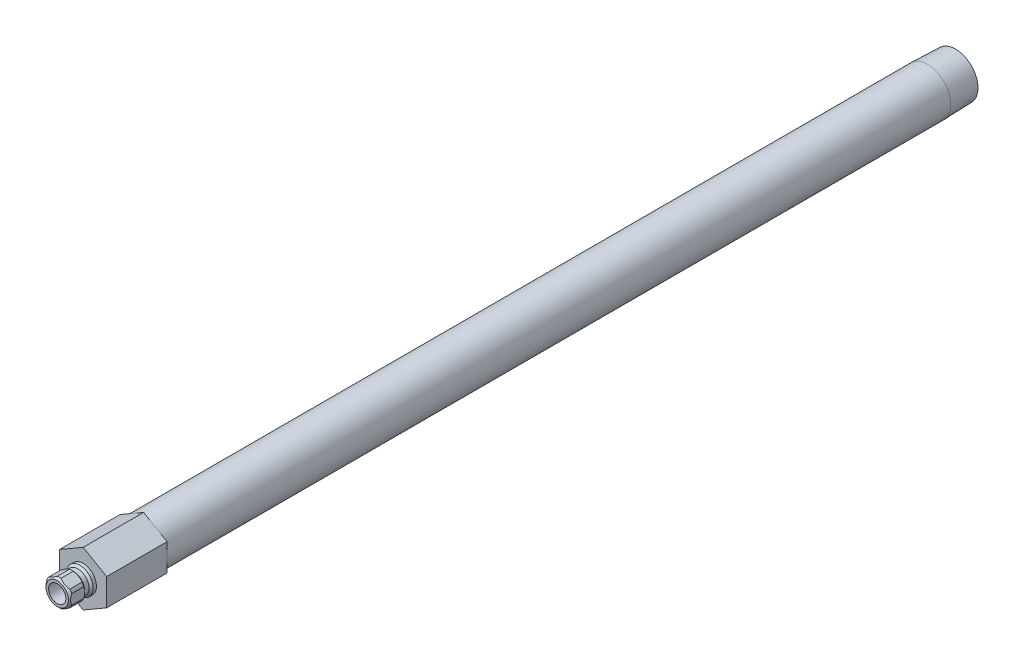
SolidWorks part; units mm, degrees
ref_plane "Front Plane" through (0, 0, 0) normal (0, 0, 1) x (1, 0, 0)
ref_plane "Top Plane" through (0, 0, 0) normal (0, 1, 0) x (1, 0, 0)
ref_plane "Right Plane" through (0, 0, 0) normal (1, 0, 0) x (0, 0, -1)
sketch "Sketch1" plane through (0, 0, 0) normal (1, 0, 0) x (0, 0, -1)
  line L0 (0, 0) -> (-12.7, 0) construction
  line L1 (-9.525, 3.175) -> (-9.525, 4.1275)
  line L2 (-3.556, 4.1275) -> (-3.556, 0) construction
  line L3 (-8.763, 4.8895) -> (-4.318, 4.8895)
  line L4 (0, 8.5725) -> (0, 0) construction
  line L5 (-3.556, 4.1275) -> (-1.9685, 4.1275)
  line L6 (-1.2065, 4.8895) -> (0, 4.8895)
  line L7 (0, 4.8895) -> (0, 8.5725)
  line L8 (-3.556, 4.1275) -> (-4.318, 4.8895)
  line L9 (-1.9685, 4.1275) -> (-1.2065, 4.8895)
  line L10 (-9.525, 4.1275) -> (-8.763, 4.8895)
  line L11 (-9.525, 3.175) -> (22.225, 3.175)
  line L12 (0, 8.5725) -> (310.3372, 8.5725)
  line L13 (310.3372, 8.5725) -> (320.675, 8.2494)
  line L14 (320.675, 8.2494) -> (320.675, 6.2611)
  line L15 (0, 0) -> (22.225, 0) construction
  line L16 (22.225, 0) -> (22.225, 3.175) construction
  line L17 (22.225, 4.8895) -> (0, 4.8895) construction
  line L18 (22.225, 3.175) -> (22.225, 6.2611)
  line L19 (22.225, 6.2611) -> (320.675, 6.2611)
  line L20 (22.225, 3.175) -> (22.225, 4.8895) construction
  dimension "D1" = 9.525
  dimension "D2" = 1.5875
  dimension "D3" = 0.762
  dimension "D4" = 45
  dimension "D5" = 5.969
  dimension "D6" = 45
  dimension "D7" = 1.79
  dimension "D8" = 10.3378
  dimension "D9" = 330.2
  dimension "D10" = 3.175
  dimension "D11" = 31.75
  dimension "D12" = 6.35
  dimension "D13" = 12.5222
  dimension "D14" = 9.779
  dimension "D15" = 17.145
revolve "Revolve1" add sketch "Sketch1" angle 360 about L0
sketch "Sketch2" plane through (0, 0, 0) normal (0, 0, 1) x (1, 0, 0)
  line L1 (-8.636, 4.986) -> (-8.636, -4.986)
  line L2 (-8.636, -4.986) -> (0, -9.972)
  line L3 (0, -9.972) -> (8.636, -4.986)
  line L4 (8.636, -4.986) -> (8.636, 4.986)
  line L5 (8.636, 4.986) -> (0, 9.972)
  line L6 (0, 9.972) -> (-8.636, 4.986)
  circle A0 centre (0, 0) radius 8.636 construction
  circle A1 centre (0, 0) radius 3.175 construction
  circle A2 centre (0, 0) radius 3.175
  dimension "D1" = 17.272
extrude "Boss-Extrude1" add sketch "Sketch2" against normal up to vertex (22.225 mm away) from vertex at 0
sketch "Sketch3" plane through (0, 0, 0) normal (0, 0, 1) x (1, 0, 0)
  line L1 (4.5212, 2.6103) -> (0, 5.2206)
  line L2 (0, 5.2206) -> (-4.5212, 2.6103)
  line L3 (-4.5212, 2.6103) -> (-4.5212, -2.6103)
  line L4 (-4.5212, -2.6103) -> (0, -5.2206)
  line L5 (0, -5.2206) -> (4.5212, -2.6103)
  line L6 (4.5212, -2.6103) -> (4.5212, 2.6103)
  circle A0 centre (0, 0) radius 4.5212 construction
  dimension "D1" = 9.0424
extrude "Cut-Extrude1" cut sketch "Sketch3" along normal through all from vertex at 3.556 flip side to cut
